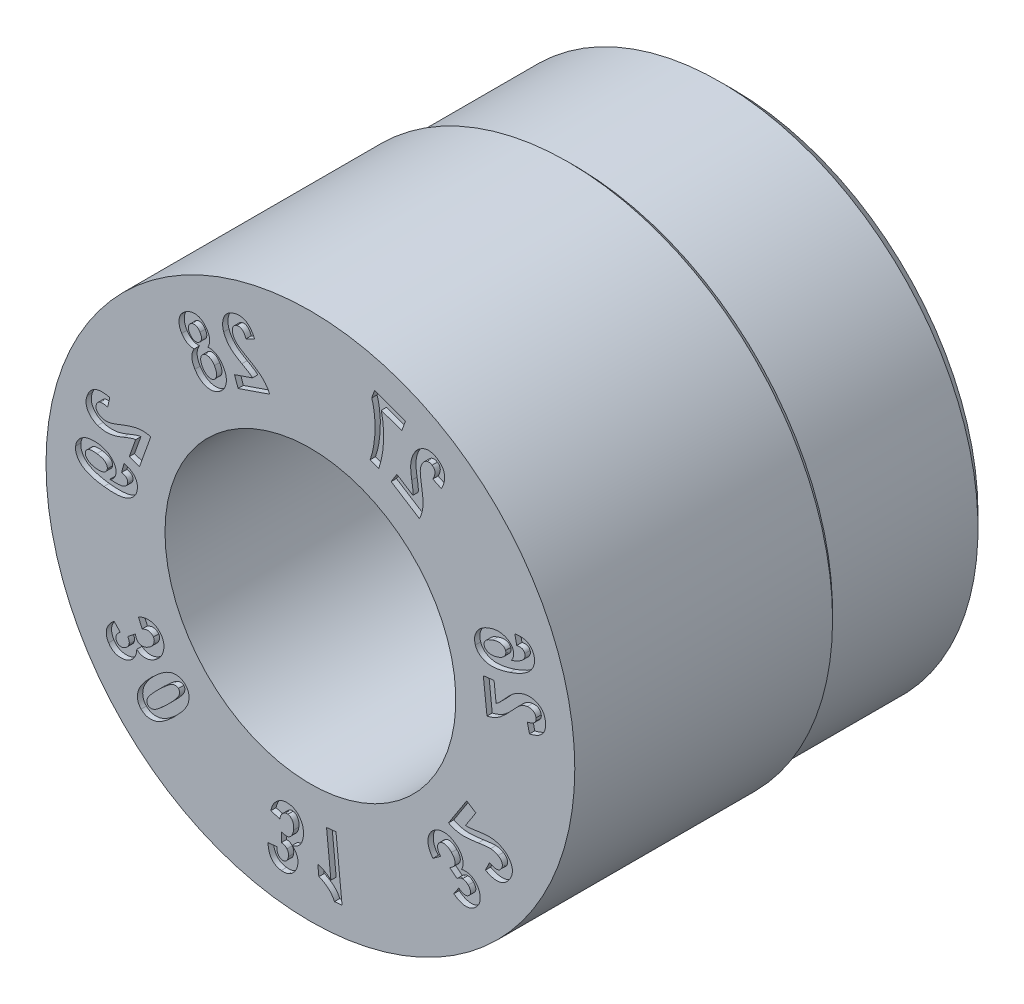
SolidWorks part; units mm, degrees
ref_plane "Front Plane" through (0, 0, 0) normal (0, 0, 1) x (1, 0, 0)
ref_plane "Top Plane" through (0, 0, 0) normal (0, 1, 0) x (1, 0, 0)
ref_plane "Right Plane" through (0, 0, 0) normal (1, 0, 0) x (0, 0, -1)
sketch "Sketch2" plane through (0, 0, 0) normal (0, 1, 0) x (1, 0, 0)
  line L0 (0, 4.8491) -> (0, -49995.1509) construction
  line L10 (9.2496, 16) -> (2, 16)
  line L11 (9.75, 15.4996) -> (9.2496, 16)
  line L12 (9.75, 10) -> (9.75, 15.4996)
  line L13 (10, 9.75) -> (9.75, 10)
  line L14 (10, 0) -> (10, 9.75)
  line L15 (5.5, 0) -> (10, 0)
  line L16 (5.5, 0) -> (5.5, 12)
  line L17 (2, 12) -> (5.5, 12)
  line L18 (2, 12) -> (2, 16)
  dimension "D1" = 20
  dimension "D2" = 11
  dimension "D3" = 4
  dimension "D4" = 4
  dimension "D5" = 19.5
  dimension "D6" = 16
  dimension "D7" = 45
  dimension "D8" = 45
  dimension "D9" = 6
  dimension "D10" = 0.5004
revolve "Revolve1" add sketch "Sketch2" angle 360 about L0
sketch "Sketch9" plane through (0, 0, 0) normal (0, 0, 1) x (1, 0, 0)
  line L0 (0, 0) -> (0, 10) construction
  line L1 (0, 0) -> (7.8183, 6.2349) construction
  line L2 (0, 0) -> (9.7493, -2.2252) construction
  line L3 (0, 0) -> (4.3388, -9.0097) construction
  line L4 (0, 0) -> (-4.3388, -9.0097) construction
  line L5 (0, 0) -> (-9.7493, -2.2252) construction
  line L6 (0, 0) -> (-7.8183, 6.2349) construction
  circle A0 centre (0, 0) radius 10 construction
  circle A30 centre (0, 0) radius 6.6854 construction
  text T0 "26    27    28    29    30    31    32" font "Arial Narrow" height 2.29
  point P12 (0, 0)
  dimension "D1" = 7
extrude "Cut-Extrude3" cut sketch "Sketch9" against normal blind 0.2
